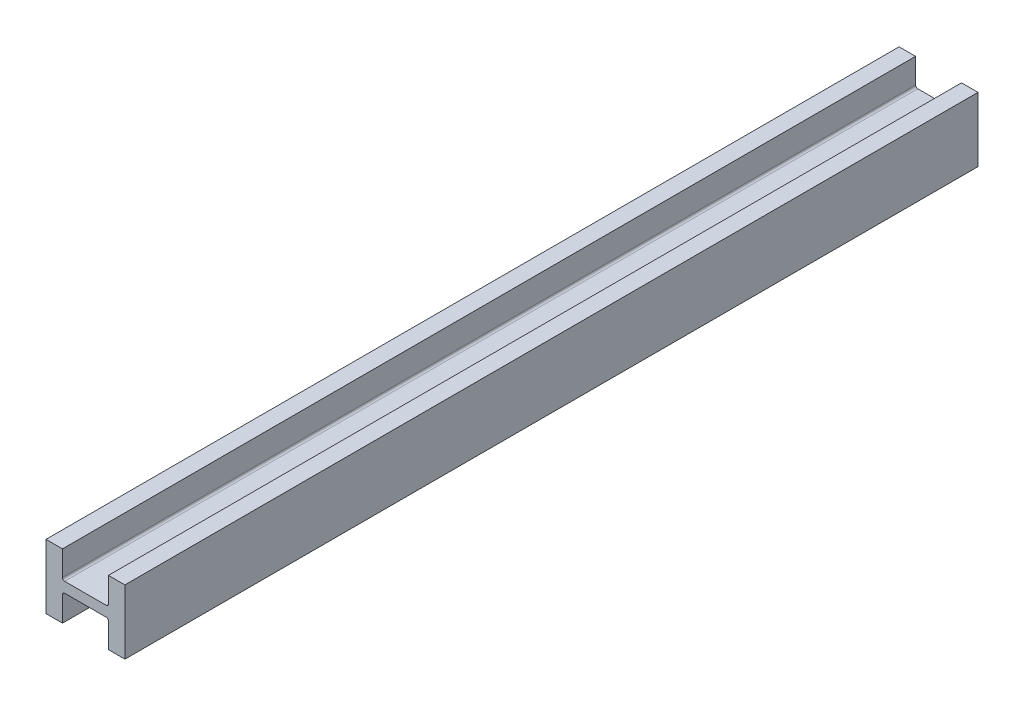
SolidWorks part; units mm, degrees
ref_plane "Front Plane" through (0, 0, 0) normal (1, 0, 0) x (0, 1, 0)
ref_plane "Top Plane" through (0, 0, 0) normal (0, 0, 1) x (0, 1, 0)
ref_plane "Right Plane" through (0, 0, 0) normal (0, 1, 0) x (-1, 0, 0)
ref_plane "Flat pln South" through (-160.02, 0, 0) normal (1, 0, 0) x (0, 1, 0)
ref_plane "Flat pln North" through (160.02, 0, 0) normal (1, 0, 0) x (0, 1, 0)
sketch "sk W14x730"
sketch_block_instance "W14x730-1"
sketch_block "W14x730" parameters "D4"=15.24, "D1"=454.406, "D2"=569.468, "D3"=77.978, "D5"=124.714, "D6"=6.35
sketch "sk W14x665"
  point P0 (-224.155, -274.828)
  point P1 (-35.941, 0)
  point P2 (0, -274.828)
sketch_block_instance "W14x665-1"
sketch_block "W14x665" parameters "D4"=15.24, "D1"=448.31, "D2"=549.656, "D3"=71.882, "D5"=114.808
extrude "665" add sketch "sk W14x665" along normal mid plane 5943.6
sketch "sk w14x605"
  point P0 (-221.1705, -265.684)
  point P1 (-32.9565, 0)
  point P3 (0, -265.684)
sketch_block_instance "w14x605-2"
sketch_block "w14x605" parameters "D4"=15.24, "D1"=442.341, "D2"=531.368, "D3"=65.913, "D5"=105.664
sketch "sk w14x550"
  point P0 (-218.44, -257.048)
  point P1 (0, -257.048)
  point P2 (-30.226, 0)
sketch_block_instance "w14x550-1"
sketch_block "w14x550" parameters "D4"=15.24, "D1"=436.88, "D2"=514.096, "D3"=60.452, "D5"=97.028
sketch "sk w14x500"
  point P0 (-216.027, -248.92)
  point P1 (-27.813, 0)
  point P2 (0, -248.92)
sketch_block_instance "w14x500-1"
sketch_block "w14x500" parameters "D4"=15.24, "D1"=432.054, "D2"=497.84, "D3"=55.626, "D5"=88.9
sketch "sk w14x455"
  point P0 (-213.8045, -241.554)
  point P1 (0, -241.554)
  point P2 (-25.5905, 0)
sketch_block_instance "w14x455-1"
sketch_block "w14x455" parameters "D4"=15.24, "D1"=427.609, "D2"=483.108, "D3"=51.181, "D5"=81.534
sketch "sk w14x426"
sketch_block_instance "w14x426-1"
sketch_block "w14x426" parameters "D4"=15.24, "D1"=424.053, "D2"=474.218, "D3"=47.625, "D5"=77.089, "D6"=6.35
sketch "sk w14x370"
  point P0 (-209.2325, -227.584)
  point P1 (-21.0185, 0)
  point P2 (0, -227.584)
sketch_block_instance "w14x370-1"
sketch_block "w14x370" parameters "D4"=15.24, "D1"=418.465, "D2"=455.168, "D3"=42.037, "D5"=67.564
sketch "sk w14x311"
  point P0 (-206.121, -217.424)
  point P1 (-17.907, 0)
  point P2 (0, -217.424)
sketch_block_instance "w14x311-1"
sketch_block "w14x311" parameters "D4"=15.24, "D1"=412.242, "D2"=434.848, "D3"=35.814, "D5"=57.404
sketch "sk w14x257"
  point P0 (-203.1365, -208.026)
  point P1 (-14.9225, 0)
  point P3 (0, -208.026)
sketch_block_instance "w14x257-2"
sketch_block "w14x257" parameters "D4"=15.24, "D1"=406.273, "D2"=416.052, "D3"=29.845, "D5"=48.006
sketch "sk w14x193"
  point P0 (-199.517, -196.596)
  point P1 (-11.303, 0)
  point P2 (0, -196.596)
sketch_block_instance "w14x193-2"
sketch_block "w14x193" parameters "D4"=15.24, "D1"=399.034, "D2"=393.192, "D3"=22.606, "D5"=36.576
